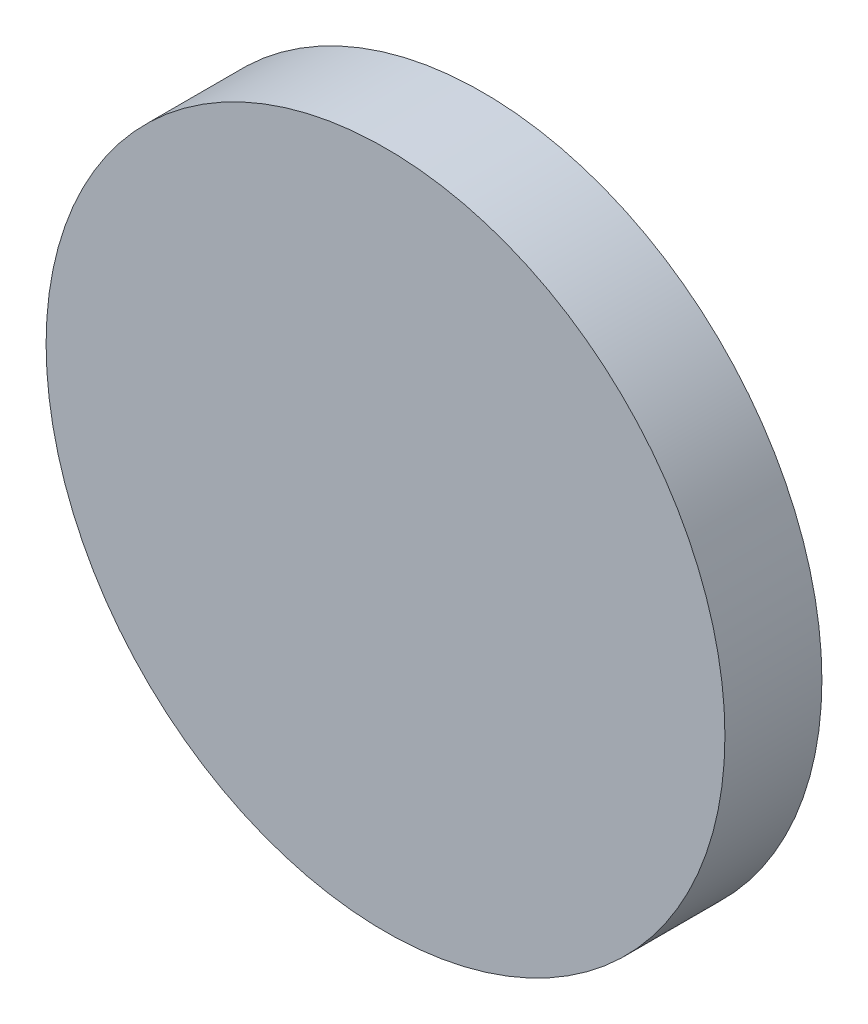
SolidWorks part; units mm, degrees
ref_plane "Alzado" through (0, 0, 0) normal (0, 0, 1) x (1, 0, 0)
ref_plane "Planta" through (0, 0, 0) normal (0, 1, 0) x (1, 0, 0)
ref_plane "Vista lateral" through (0, 0, 0) normal (1, 0, 0) x (0, 0, -1)
sketch "Croquis1" plane through (0, 0, 0) normal (0, 0, 1) x (1, 0, 0)
  circle A0 centre (0, 0) radius 3.5
extrude "Saliente-Extruir1" add sketch "Croquis1" along normal blind 1
